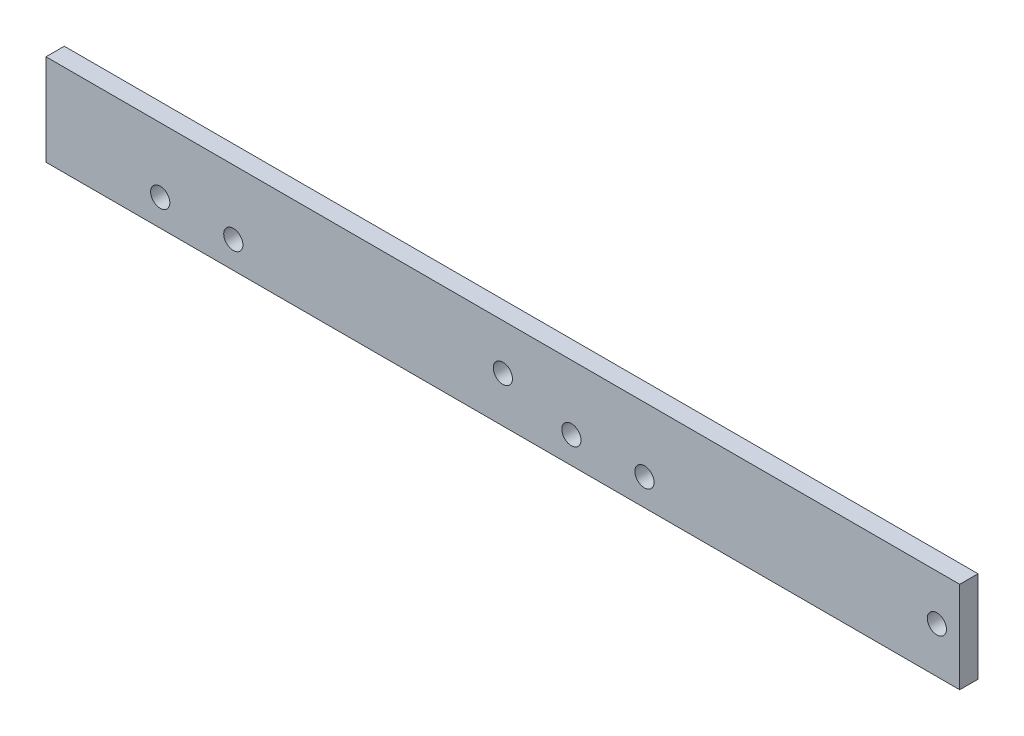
SolidWorks part; units mm, degrees
ref_plane "前视基准面" through (0, 0, 0) normal (0, 0, 1) x (1, 0, 0)
ref_plane "上视基准面" through (0, 0, 0) normal (0, 1, 0) x (1, 0, 0)
ref_plane "右视基准面" through (0, 0, 0) normal (1, 0, 0) x (0, 0, -1)
sketch "草图1" plane through (0, 0, 0) normal (0, 0, 1) x (1, 0, 0)
  line L1 (-100, -10) -> (100, -10)
  line L2 (-100, -10) -> (-100, 10)
  line L3 (-100, 10) -> (100, 10)
  line L4 (100, -10) -> (100, 10)
  line L5 (-100, -10) -> (100, 10) construction
  line L6 (-100, 10) -> (100, -10) construction
  circle A0 centre (95, 0) radius 2.1
  circle A1 centre (0, 0) radius 2.1
  point P0 (0, 0)
  point P10 (0, 0)
  dimension "D3" = 4.2
  dimension "D4" = 5
  dimension "D5" = 95
  dimension "D1" = 200
  dimension "D2" = 20
extrude "凸台-拉伸1" add sketch "草图1" along normal blind 4
sketch "草图2" plane through (0, 0, 4) normal (0, 0, 1) x (1, 0, 0)
  circle A0 centre (31, -4.1292) radius 2.1
  circle A1 centre (15, -4.1292) radius 2.1
  circle A2 centre (-59, -4.1292) radius 2.1
  circle A3 centre (-75, -4.1292) radius 2.1
  dimension "D1" = 4.2
extrude "切除-拉伸1" cut sketch "草图2" against normal through all
